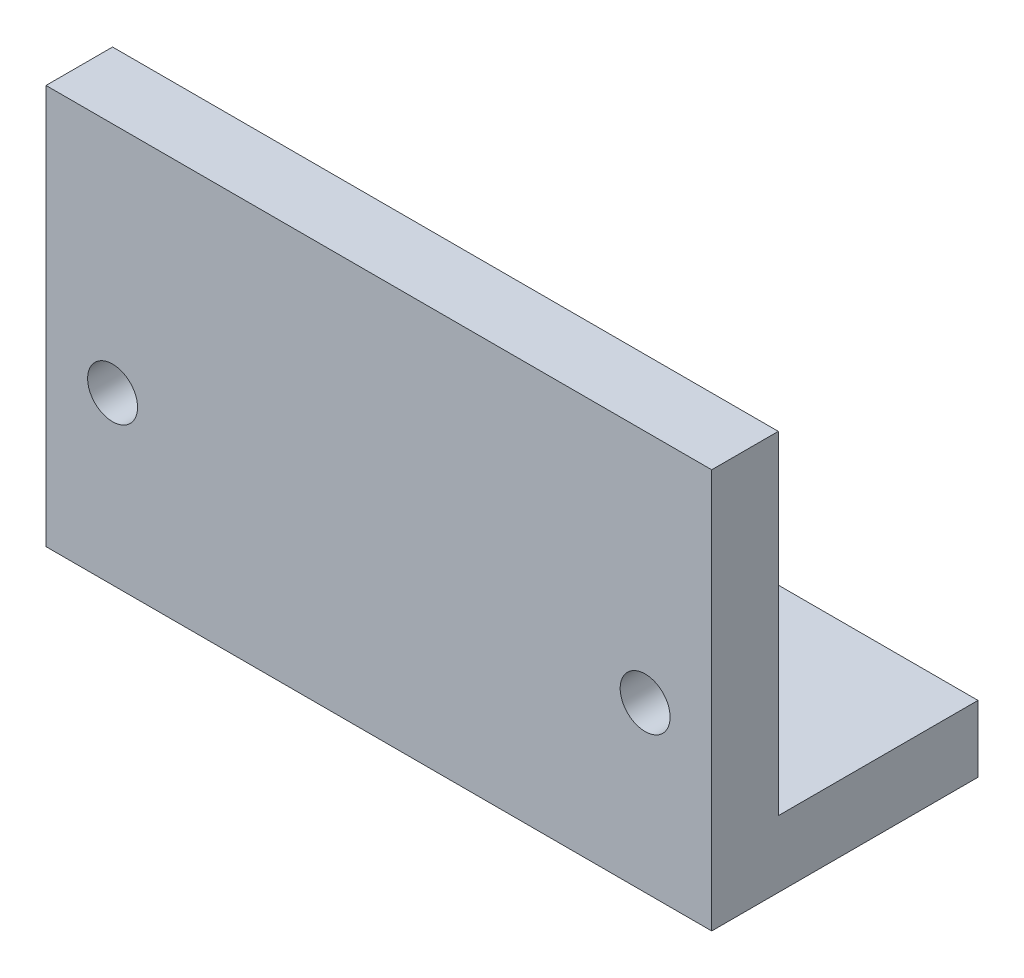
SolidWorks part; units mm, degrees
ref_plane "正面" through (0, 0, 0) normal (0, 0, 1) x (1, 0, 0)
ref_plane "平面" through (0, 0, 0) normal (0, 1, 0) x (1, 0, 0)
ref_plane "右側面" through (0, 0, 0) normal (1, 0, 0) x (0, 0, -1)
sketch "ｽｹｯﾁ1" plane through (0, 0, 0) normal (0, 0, 1) x (1, 0, 0)
  line L1 (0, 0) -> (200, 0)
  line L2 (0, 0) -> (0, 120)
  line L3 (0, 120) -> (200, 120)
  line L4 (200, 0) -> (200, 120)
  dimension "D1" = 200
  dimension "D2" = 120
extrude "押し出し1" add sketch "ｽｹｯﾁ1" along normal blind 20
sketch "ｽｹｯﾁ2" plane through (0, 0, 0) normal (0, 0, -1) x (-1, 0, 0)
  line L0 (0, 120) -> (0, 0) construction
  line L1 (-200, 0) -> (0, 0)
  line L2 (-200, 0) -> (-200, 20)
  line L3 (-200, 20) -> (0, 20)
  line L4 (0, 0) -> (0, 20)
  dimension "D1" = 20
extrude "押し出し2" add sketch "ｽｹｯﾁ2" along normal blind 60
sketch "ｽｹｯﾁ3" plane through (0, 0, 20) normal (0, 0, 1) x (1, 0, 0)
  line L0 (0, 120) -> (0, 0) construction
  line L2 (0, 0) -> (200, 0) construction
  circle A0 centre (20, 50) radius 7.5
  dimension "D3" = 15
  dimension "D1" = 20
  dimension "D2" = 50
extrude "押し出し3" cut sketch "ｽｹｯﾁ3" against normal through all
sketch "ｽｹｯﾁ4" plane through (0, 0, 20) normal (0, 0, 1) x (1, 0, 0)
  circle A0 centre (180, 49.3881) radius 7.5
  circle A1 centre (20, 50) radius 7.5 construction
  dimension "D1" = 15
  dimension "D2" = 160
extrude "押し出し4" cut sketch "ｽｹｯﾁ4" against normal through all
